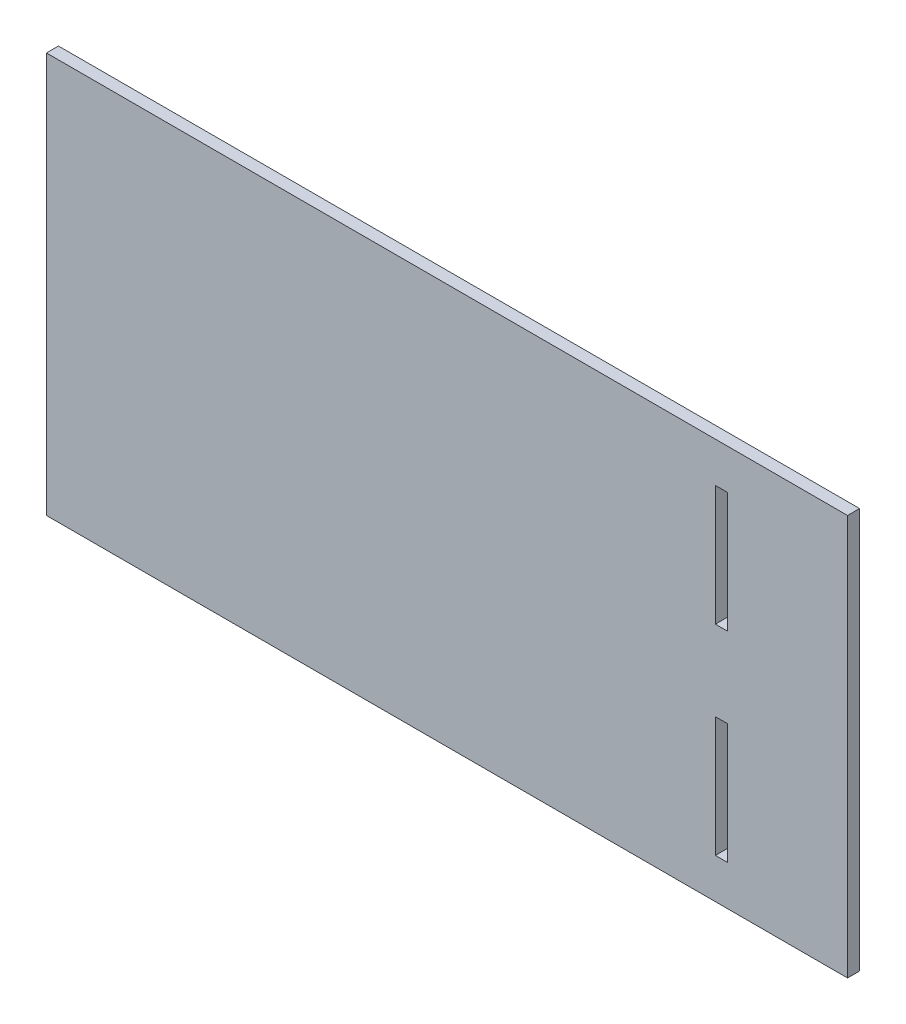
SolidWorks part; units mm, degrees
ref_plane "Plan de face" through (0, 0, 0) normal (0, 0, 1) x (1, 0, 0)
ref_plane "Plan de dessus" through (0, 0, 0) normal (0, 1, 0) x (1, 0, 0)
ref_plane "Plan de droite" through (0, 0, 0) normal (1, 0, 0) x (0, 0, -1)
sketch "Esquisse1" plane through (0, 0, 0) normal (0, 0, 1) x (1, 0, 0)
  line L1 (-100, -50) -> (100, -50)
  line L2 (-100, -50) -> (-100, 50)
  line L3 (-100, 50) -> (100, 50)
  line L4 (100, -50) -> (100, 50)
  line L5 (-100, -50) -> (100, 50) construction
  line L6 (-100, 50) -> (100, -50) construction
  point P0 (0, 0)
  dimension "D1" = 200
  dimension "D2" = 100
extrude "Boss.-Extru.1" add sketch "Esquisse1" along normal blind 3
sketch "Esquisse2" plane through (0, 0, 3) normal (0, 0, 1) x (1, 0, 0)
  line L0 (-100, 0) -> (100, 0) construction
  line L1 (-100, 50) -> (-100, -50) construction
  line L2 (100, -50) -> (100, 50) construction
  line L3 (67, 10) -> (70, 40) construction
  line L4 (67, -40) -> (70, -40)
  line L5 (67, -40) -> (67, -10)
  line L6 (67, -10) -> (70, -10)
  line L7 (70, -40) -> (70, -10)
  line L8 (67, -40) -> (70, -10) construction
  line L9 (67, -10) -> (70, -40) construction
  line L10 (67, 40) -> (70, 10) construction
  line L11 (70, 40) -> (70, 10)
  line L12 (67, 10) -> (70, 10)
  line L13 (67, 40) -> (67, 10)
  line L14 (67, 40) -> (70, 40)
  point P6 (68.5, -25)
  point P15 (68.5, 25)
  dimension "D1" = 3
  dimension "D2" = 30
  dimension "D3" = 10
  dimension "D4" = 30
extrude "Enlèv. mat.-Extru.1" cut sketch "Esquisse2" against normal through all
